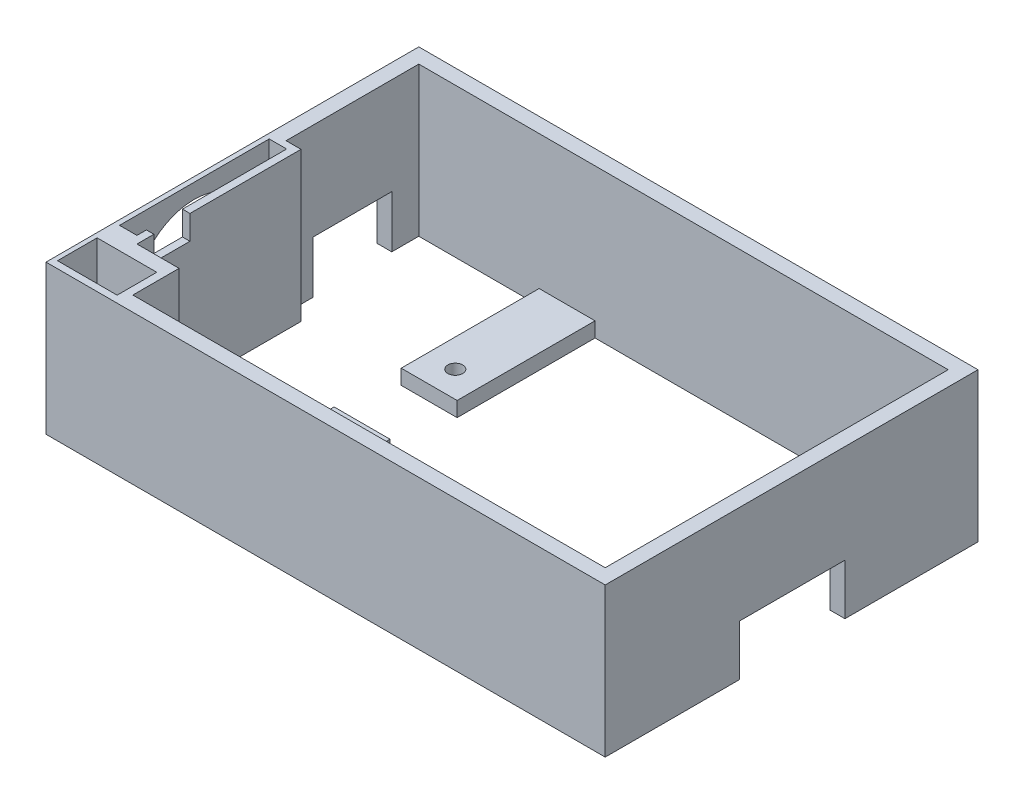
SolidWorks part; units mm, degrees
ref_plane "Front Plane" through (0, 0, 0) normal (0, 0, 1) x (1, 0, 0)
ref_plane "Top Plane" through (0, 0, 0) normal (0, 1, 0) x (1, 0, 0)
ref_plane "Right Plane" through (0, 0, 0) normal (1, 0, 0) x (0, 0, -1)
sketch "Sketch1" plane through (0, 0, 0) normal (0, 1, 0) x (1, 0, 0)
  line L1 (0, 0) -> (150, 0)
  line L2 (0, 0) -> (0, 100)
  line L3 (0, 100) -> (150, 100)
  line L4 (150, 0) -> (150, 100)
  line L5 (4, 96) -> (146, 96)
  line L6 (4, 96) -> (4, 4)
  line L7 (4, 4) -> (146, 4)
  line L8 (146, 96) -> (146, 4)
  dimension "D1" = 4
  dimension "D2" = 4
  dimension "D3" = 4
  dimension "D4" = 4
  dimension "D5" = 150
  dimension "D6" = 100
extrude "Boss-Extrude1" add sketch "Sketch1" along normal blind 40
sketch "Sketch10" plane through (4, 0, 0) normal (1, 0, 0) x (0, 0, -1)
  line L0 (96, 0) -> (4, 0) construction
  line L1 (18.3994, 0) -> (58.3994, 0)
  line L2 (18.3994, 0) -> (18.3994, 40)
  line L3 (18.3994, 40) -> (58.3994, 40)
  line L4 (58.3994, 0) -> (58.3994, 40)
  line L5 (96, 40) -> (4, 40) construction
  circle A0 centre (38.3994, 20) radius 20
  circle A1 centre (38.3994, 20) radius 16
  dimension "D1" = 40
sketch "Sketch11" plane through (4, 0, 0) normal (1, 0, 0) x (0, 0, -1)
  line L0 (18.3994, 0) -> (16.3994, 0)
  line L1 (96, 0) -> (4, 0) construction
  line L2 (16.3994, 0) -> (16.3994, 40)
  line L3 (96, 40) -> (4, 40) construction
  line L4 (16.3994, 40) -> (18.3994, 40)
  line L5 (18.3994, 40) -> (18.3994, 0)
  line L6 (58.3994, 0) -> (58.3994, 40)
  line L7 (58.3994, 40) -> (60.3994, 40)
  line L8 (60.3994, 40) -> (60.3994, 0)
  line L9 (60.3994, 0) -> (58.3994, 0)
extrude "Boss-Extrude5" add sketch "Sketch11" along normal blind 4
sketch "Sketch12" plane through (0, 0, -18.3994) normal (0, 0, -1) x (-1, 0, 0)
  line L0 (-8, 0) -> (-4, 0) construction
  line L1 (-8, 40) -> (-6, 40)
  line L2 (-8, 40) -> (-8, 0)
  line L3 (-8, 0) -> (-6, 0)
  line L4 (-6, 40) -> (-6, 0)
extrude "Boss-Extrude6" add sketch "Sketch12" along normal up to surface (42 mm away)
sketch "Sketch13" plane through (0, 40, 0) normal (0, 1, 0) x (1, 0, 0)
  line L0 (0, 100) -> (0, 0) construction
  line L1 (6, 18.3994) -> (1.32, 18.3994)
  line L2 (6, 18.3994) -> (6, 58.5494)
  line L3 (6, 58.5494) -> (1.32, 58.5494)
  line L4 (1.32, 18.3994) -> (1.32, 58.5494)
  line L5 (6, 58.3994) -> (6, 18.3994) construction
  line L6 (8, 60.3994) -> (8, 16.3994) construction
  dimension "D1" = 4.68
  dimension "D2" = 40.15
  dimension "D3" = 1.32
  dimension "D4" = 2
extrude "Cut-Extrude4" cut sketch "Sketch13" against normal up to surface (40 mm away)
extrude "Cut-Extrude5" cut sketch "Sketch10" against normal blind 42 contours A1
sketch "Sketch14" plane through (0, 0, 0) normal (0, -1, 0) x (-1, 0, 0)
  line L0 (-4, 4) -> (-146, 4) construction
  line L1 (-36.279, 4) -> (-51.279, 4)
  line L2 (-36.279, 4) -> (-36.279, 41)
  line L3 (-36.279, 41) -> (-51.279, 41)
  line L4 (-51.279, 4) -> (-51.279, 41)
  line L5 (-146, 96) -> (-4, 96) construction
  line L6 (-36.279, 96) -> (-51.279, 96)
  line L7 (-36.279, 96) -> (-36.279, 59)
  line L8 (-36.279, 59) -> (-51.279, 59)
  line L9 (-51.279, 96) -> (-51.279, 59)
  line L11 (-127.5398, 96) -> (-112.5398, 96)
  line L12 (-127.5398, 96) -> (-127.5398, 59)
  line L13 (-127.5398, 59) -> (-112.5398, 59)
  line L14 (-112.5398, 96) -> (-112.5398, 59)
  line L21 (-127.5398, 4) -> (-112.5398, 4)
  line L22 (-127.5398, 4) -> (-127.5398, 41)
  line L23 (-127.5398, 41) -> (-112.5398, 41)
  line L24 (-112.5398, 4) -> (-112.5398, 41)
  circle A4 centre (-43.779, 34) radius 2
  circle A6 centre (-43.779, 66) radius 2
  circle A7 centre (-120.0398, 65.2431) radius 2
  circle A8 centre (-120.0398, 34) radius 2
  dimension "D8" = 15
  dimension "D4" = 7
  dimension "D1" = 37
  dimension "D2" = 15
  dimension "D3" = 37
  dimension "D5" = 7
  dimension "D7" = 37
sketch "Sketch15" plane through (4, 0, 0) normal (1, 0, 0) x (0, 0, -1)
  line L0 (96, 0) -> (60.3994, 0) construction
  line L2 (67.65, 0) -> (67.65, 14)
  line L3 (67.65, 14) -> (88.75, 14)
  line L4 (88.75, 0) -> (88.75, 14)
  line L5 (96, 40) -> (96, 0) construction
  line L9 (67.65, 0) -> (88.75, 0)
  line L11 (60.3994, 0) -> (60.3994, 40) construction
  line L12 (60.3994, 0) -> (60.3994, 40) construction
  point P12 (60.3994, 0)
  dimension "D1" = 21.1
  dimension "D2" = 14
  dimension "D3" = 7.25
  dimension "D4" = 7.2506
  dimension "D5" = 35.6006
extrude "Cut-Extrude6" cut sketch "Sketch15" against normal blind 10
extrude "Boss-Extrude7" add sketch "Sketch14" against normal blind 4
sketch "Sketch16" plane through (150, 0, 0) normal (1, 0, 0) x (0, 0, -1)
  line L0 (0, 0) -> (100, 0) construction
  line L1 (36.0481, 0) -> (64.3045, 0)
  line L2 (36.0481, 0) -> (36.0481, 13.6043)
  line L3 (36.0481, 13.6043) -> (64.3045, 13.6043)
  line L4 (64.3045, 0) -> (64.3045, 13.6043)
extrude "Cut-Extrude7" cut sketch "Sketch16" against normal up to surface (4 mm away)
sketch "Sketch17" plane through (0, 40, 0) normal (0, 1, 0) x (1, 0, 0)
  line L0 (4, 4) -> (146, 4) construction
  line L1 (4, 16.3994) -> (19.3, 16.3994)
  line L2 (4, 16.3994) -> (4, 4)
  line L3 (4, 4) -> (19.3, 4)
  line L4 (19.3, 16.3994) -> (19.3, 4)
  dimension "D1" = 15.3
extrude "Boss-Extrude8" add sketch "Sketch17" against normal up to surface (40 mm away)
sketch "Sketch18" plane through (0, 40, 0) normal (0, 1, 0) x (1, 0, 0)
  line L1 (1.22, 1.8626) -> (17.22, 1.8626)
  line L2 (1.22, 1.8626) -> (1.22, 12.4926)
  line L3 (1.22, 12.4926) -> (17.22, 12.4926)
  line L4 (17.22, 1.8626) -> (17.22, 12.4926)
  dimension "D1" = 16
  dimension "D2" = 10.63
extrude "Cut-Extrude8" cut sketch "Sketch18" against normal blind 20
sketch "Sketch19" plane through (0, 0, -12.4926) normal (0, 0, 1) x (1, 0, 0)
  line L0 (17.22, 20) -> (1.22, 20) construction
  line L1 (11.2343, 20) -> (16.1452, 20)
  line L2 (11.2343, 20) -> (11.2343, 30)
  line L3 (11.2343, 30) -> (16.1452, 30)
  line L4 (16.1452, 20) -> (16.1452, 30)
extrude "Cut-Extrude9" cut sketch "Sketch19" against normal blind 20
sketch "Sketch20" plane through (8, 0, 0) normal (1, 0, 0) x (0, 0, -1)
  line L0 (60.3994, 40) -> (16.3994, 40) construction
  line L1 (20.9377, 40) -> (30.6084, 40)
  line L2 (20.9377, 40) -> (20.9377, 33.5357)
  line L3 (20.9377, 33.5357) -> (30.6084, 33.5357)
  line L4 (30.6084, 40) -> (30.6084, 33.5357)
extrude "Cut-Extrude10" cut sketch "Sketch20" against normal blind 4
sketch "Sketch21" plane through (0, 40, 0) normal (0, 1, 0) x (1, 0, 0)
  line L0 (8, 16.3994) -> (0, 16.3994)
  line L1 (0, 100) -> (0, 0) construction
  line L2 (0, 16.3994) -> (19.3, 16.3994)
  line L3 (19.3, 16.3994) -> (19.3, 0)
  line L4 (0, 0) -> (150, 0) construction
  dimension "D1" = 19.3
  dimension "D2" = 16.3994
